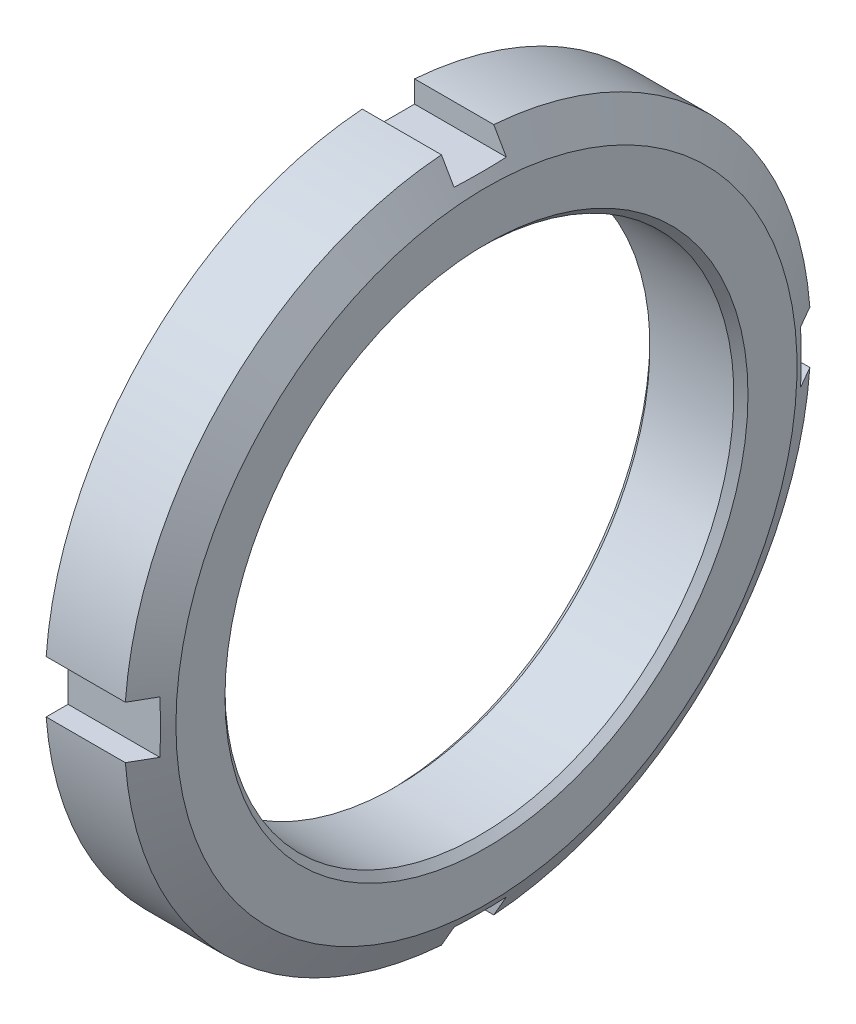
SolidWorks part; units mm, degrees
ref_plane "Plan de face" through (0, 0, 0) normal (0, 0, 1) x (1, 0, 0)
ref_plane "Plan de dessus" through (0, 0, 0) normal (0, 1, 0) x (1, 0, 0)
ref_plane "Plan de droite" through (0, 0, 0) normal (1, 0, 0) x (0, 0, -1)
sketch "Esquisse1" plane through (0, 0, 0) normal (0, 0, 1) x (1, 0, 0)
  line L0 (0, 0) -> (0, 52.5)
  line L1 (0, 52.5) -> (12.1132, 52.5)
  line L2 (12.1132, 52.5) -> (15, 47.5)
  line L3 (15, 47.5) -> (15, 0)
  line L4 (15, 0) -> (0, 0)
  line L5 (15, 0) -> (0, 0) construction
revolve "Révolution1" add sketch "Esquisse1" angle 360 about L5
sketch "Esquisse2" plane through (0, 0, 0) normal (0, 0, 1) x (1, 0, 0)
  line L0 (0, 0) -> (0, 40)
  line L1 (0, 40) -> (1.0825, 38.9175)
  line L2 (1.0825, 38.9175) -> (13.9175, 38.9175)
  line L3 (13.9175, 38.9175) -> (15, 40)
  line L4 (15, 40) -> (15, 0)
  line L5 (15, 0) -> (0, 0)
  line L6 (15, 0) -> (0, 0) construction
revolve "Enlèvement de matière-Révolution1" cut sketch "Esquisse2" angle 360 about L6
sketch "Esquisse3" plane through (0, 0, 0) normal (1, 0, 0) x (0, 0, -1)
  line L0 (-105, 105) -> (-105, -105)
  line L1 (-105, -105) -> (105, -105)
  line L2 (105, -105) -> (105, 105)
  line L3 (105, 105) -> (-105, 105)
  line L4 (-52.5, 4) -> (-49, 4)
  line L5 (-49, 4) -> (-49, -4)
  line L6 (-49, -4) -> (-52.5, -4)
  line L7 (-52.5, -4) -> (-52.5, -52.5)
  line L8 (-52.5, -52.5) -> (-4, -52.5)
  line L9 (-4, -52.5) -> (-4, -49)
  line L10 (-4, -49) -> (4, -49)
  line L11 (4, -49) -> (4, -52.5)
  line L12 (4, -52.5) -> (52.5, -52.5)
  line L13 (52.5, -52.5) -> (52.5, -4)
  line L14 (52.5, -4) -> (49, -4)
  line L15 (49, -4) -> (49, 4)
  line L16 (49, 4) -> (52.5, 4)
  line L17 (52.5, 4) -> (52.5, 52.5)
  line L18 (52.5, 52.5) -> (4, 52.5)
  line L19 (4, 52.5) -> (4, 49)
  line L20 (4, 49) -> (-4, 49)
  line L21 (-4, 49) -> (-4, 52.5)
  line L22 (-4, 52.5) -> (-52.5, 52.5)
  line L23 (-52.5, 52.5) -> (-52.5, 4)
extrude "Enlèv. mat.-Extru.1" cut sketch "Esquisse3" along normal blind 15
sketch "Esquisse4" plane through (15, 0, 0) normal (1, 0, 0) x (0, 0, -1)
  line L1 (-60.8501, 0) -> (67.157, 0)
  line L2 (-60.8501, 0) -> (-60.8501, -68.9089)
  line L3 (-60.8501, -68.9089) -> (67.157, -68.9089)
  line L4 (67.157, 0) -> (67.157, -68.9089)
extrude "Enlèv. mat.-Extru.2" [suppressed] cut sketch "Esquisse4" against normal through all
